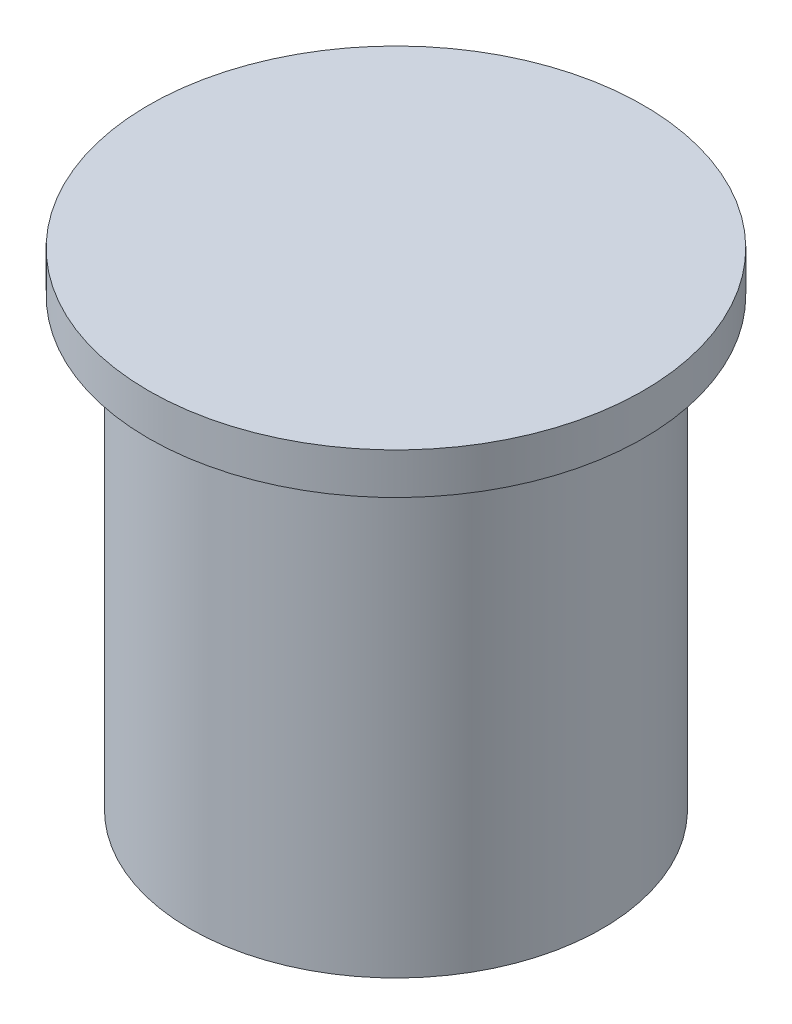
SolidWorks part; units mm, degrees
ref_plane "Front Plane" through (0, 0, 0) normal (0, 0, 1) x (1, 0, 0)
ref_plane "Top Plane" through (0, 0, 0) normal (0, 1, 0) x (1, 0, 0)
ref_plane "Right Plane" through (0, 0, 0) normal (1, 0, 0) x (0, 0, -1)
sketch "Sketch1" plane through (0, 0, 0) normal (0, 1, 0) x (1, 0, 0)
  circle A0 centre (0, 0) radius 15.875
  dimension "D1" = 31.75
extrude "Boss-Extrude1" add sketch "Sketch1" along normal blind 34.29
sketch "Sketch2" plane through (0, 34.29, 0) normal (0, 1, 0) x (1, 0, 0)
  circle A0 centre (0, 0) radius 19.05
  dimension "D1" = 38.1
extrude "Boss-Extrude2" add sketch "Sketch2" along normal blind 3.175
